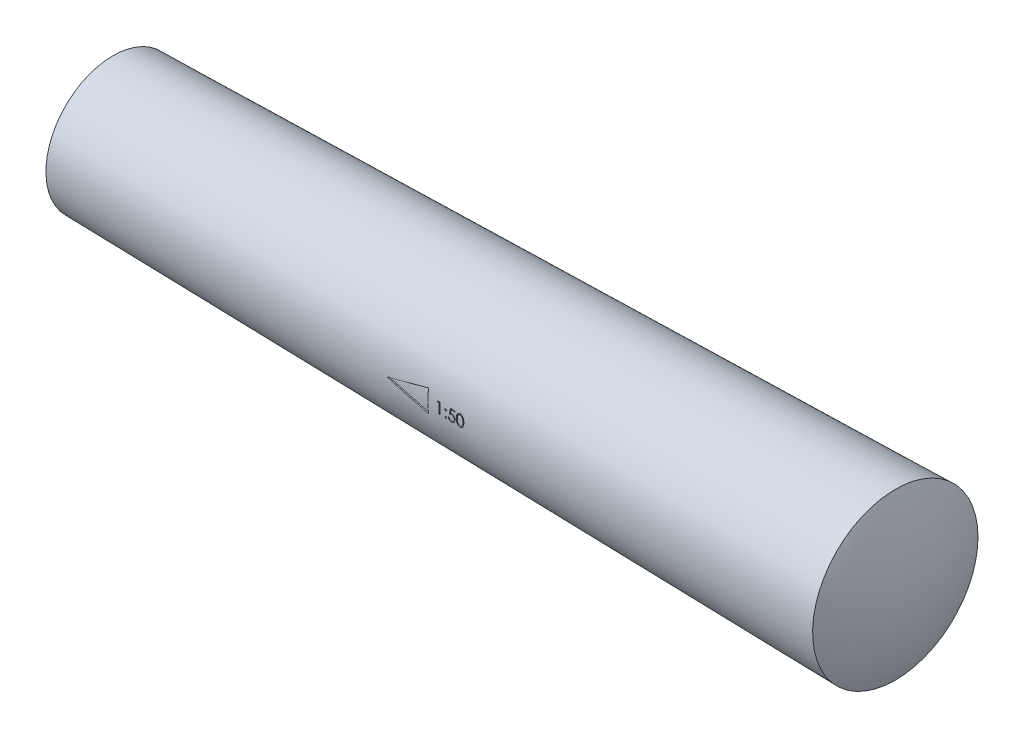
SolidWorks part; units mm, degrees
ref_plane "Front Plane" through (0, 0, 0) normal (0, 0, 1) x (1, 0, 0)
ref_plane "Top Plane" through (0, 0, 0) normal (0, 1, 0) x (1, 0, 0)
ref_plane "Right Plane" through (0, 0, 0) normal (1, 0, 0) x (0, 0, -1)
sketch "Sketch1" plane through (0, 0, 0) normal (1, 0, 0) x (0, 0, -1)
  circle A0 centre (0, 0) radius 6
  dimension "D1" = 12
extrude "Extrude1" add sketch "Sketch1" along normal mid plane 70
draft "Draft1" type of draft neutral plane draft angle 1.146 faces to draft 1 parameters "D1"=1.146
sketch "Sketch2" plane through (0, 0, 0) normal (0, 0, 1) x (1, 0, 0)
  line L0 (-35, 0) -> (-35, 6)
  line L1 (-35, 6) -> (-35, -6) construction
  line L2 (-35, 0) -> (-36.6, 0)
  line L3 (-36.6, 0) -> (-36.6, -6.7) construction
  line L4 (35, 0) -> (35, 7.4)
  line L5 (35, -7.4) -> (35, 7.4) construction
  line L6 (35, 0) -> (36.6, 0)
  line L7 (36.6, 0) -> (36.6, -6.7) construction
  line L8 (-35, -6) -> (35, -7.4) construction
  arc A0 (-36.6, 0) -> (-35, 6) centre (-24.55, 0) cw
  arc A1 (36.6, 0) -> (35, 7.4) centre (18.6873, 0) ccw
  point P14 (0, -6.7)
revolve "Revolve1" add sketch "Sketch2" angle 360 about L2
sketch "Sketch5" plane through (0, 0, 0) normal (0, 0, 1) x (1, 0, 0)
  line L0 (0, 6.7) -> (0, -6.7) construction
  line L1 (35, 7.4) -> (-35, 6) construction
  line L2 (-35, -6) -> (35, -7.4) construction
ref_plane "Plane2" through (0, 0, 0) normal (-0.02, 0, 0.9998) x (0.9998, 0, 0.02)
sketch "Sketch6" plane through (0, 0, 0) normal (-0.02, 0, 0.9998) x (0.9998, 0, 0.02)
  line L0 (0, 0) -> (0, 1)
  line L1 (0, 6.7) -> (0, -6.7) construction
  line L2 (0, 1) -> (-3.7321, 0)
  line L3 (-3.7321, 0) -> (0, -1)
  line L4 (0, -1) -> (0, 0)
  line L5 (0, -0.5) -> (4, -0.5) construction
  text T0 "1:50" font "Century Gothic" height 1
  dimension "D1" = 2
  dimension "D2" = 30
  dimension "D3" = 4
wrap "Wrap2" sketch "Sketch6" wrap type deboss source sketch "Sketch6" thickness 0.1 parameters "D1"=0.1
equation "\"D2@Sketch2\" = \"D1@Sketch2\""
